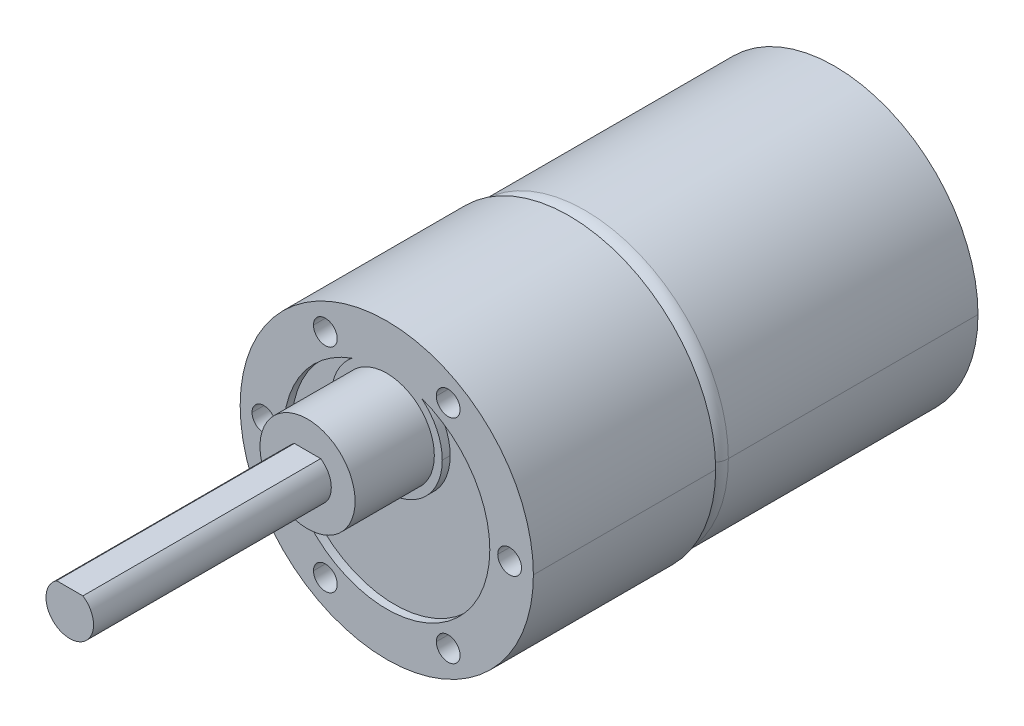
SolidWorks part; units mm, degrees
ref_plane "Front Plane" through (0, 0, 0) normal (0, 0, 1) x (1, 0, 0)
ref_plane "Top Plane" through (0, 0, 0) normal (0, 1, 0) x (1, 0, 0)
ref_plane "Right Plane" through (0, 0, 0) normal (1, 0, 0) x (0, 0, -1)
imported_body "PiBorg_Geared_12V_dc_motor_37mm.STEP<1>"
ref_plane "Plane1" through (-18.1, 0, 31.5) normal (0, 0, -1) x (-1, 0, 0)
sketch "Sketch2" plane through (0, 0, 76.5) normal (0, 0, 1) x (1, 0, 0)
  line L1 (1.6583, 9.2825) -> (-1.6583, 9.2825)
  line L2 (1.6583, 9.2825) -> (-1.6583, 9.2825)
  arc A3 (-1.6583, 9.2825) -> (-3, 6.7825) centre (0, 6.7825) ccw
  arc A4 (-3, 6.7825) -> (3, 6.7825) centre (0, 6.7825) ccw
  arc A5 (3, 6.7825) -> (1.6583, 9.2825) centre (0, 6.7825) ccw
  arc A6 (-1.6583, 9.2825) -> (-3, 6.7825) centre (0, 6.7825) ccw
  arc A7 (-3, 6.7825) -> (3, 6.7825) centre (0, 6.7825) ccw
  arc A8 (3, 6.7825) -> (1.6583, 9.2825) centre (0, 6.7825) ccw
  dimension "D1" = 0
extrude "Boss-Extrude1" add sketch "Sketch2" along normal blind 10
sketch "Sketch5" plane through (0, 0, 86.5) normal (0, 0, 1) x (1, 0, 0)
  line L1 (1.6583, 9.2825) -> (-1.6583, 9.2825)
  line L2 (1.6583, 9.2825) -> (-1.6583, 9.2825)
  arc A1 (-1.6583, 9.2825) -> (1.6583, 9.2825) centre (0, 6.7825) ccw
  arc A2 (-1.6583, 9.2825) -> (1.6583, 9.2825) centre (0, 6.7825) ccw
  dimension "D1" = 0
extrude "Boss-Extrude2" add sketch "Sketch5" along normal blind 10
sketch "Sketch7" plane through (0, 0, 61.5) normal (0, 0, 1) x (1, 0, 0)
  arc A2 (-6, 6.7825) -> (6, 6.7825) centre (0, 6.7825) ccw
  arc A3 (6, 6.7825) -> (-6, 6.7825) centre (0, 6.7825) ccw
  arc A4 (-6, 6.7825) -> (6, 6.7825) centre (0, 6.7825) ccw
  arc A5 (6, 6.7825) -> (-6, 6.7825) centre (0, 6.7825) ccw
  dimension "D1" = 0
extrude "Boss-Extrude3" add sketch "Sketch7" along normal blind 5
